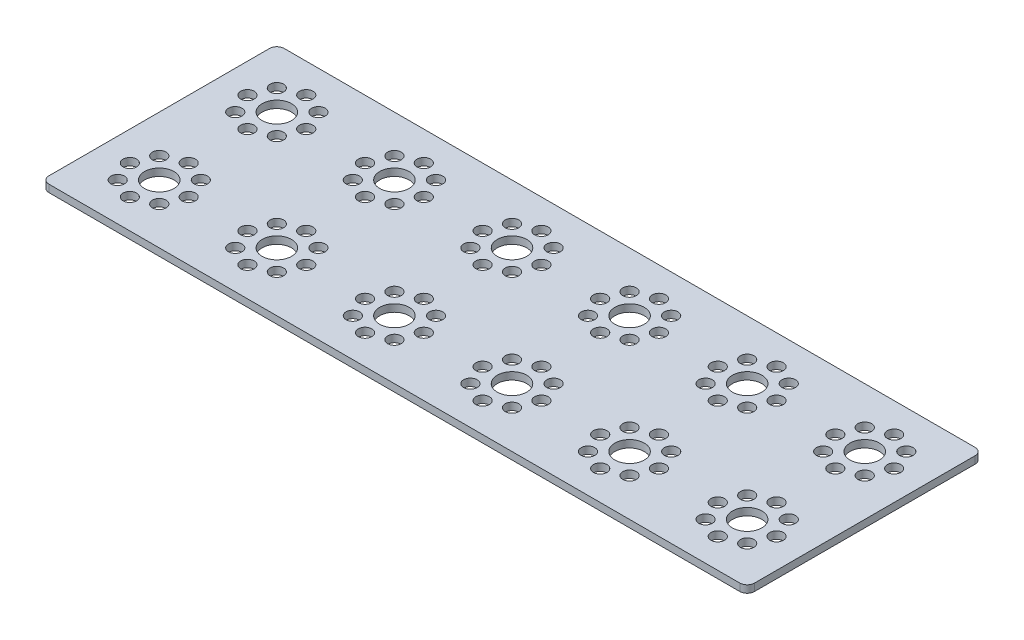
SolidWorks part; units mm, degrees
ref_plane "Front Plane" through (0, 0, 0) normal (0, 0, 1) x (1, 0, 0)
ref_plane "Top Plane" through (0, 0, 0) normal (0, 1, 0) x (1, 0, 0)
ref_plane "Right Plane" through (0, 0, 0) normal (1, 0, 0) x (0, 0, -1)
sketch "Sketch1" plane through (0, 0, 0) normal (0, 1, 0) x (1, 0, 0)
  line L1 (0, 0) -> (192, 0)
  line L2 (0, 0) -> (0, 64)
  line L3 (0, 64) -> (192, 64)
  line L4 (192, 0) -> (192, 64)
  dimension "D1" = 192
  dimension "D2" = 64
extrude "Extrude1" add sketch "Sketch1" along normal blind 2
sketch "Sketch2" plane through (0, 2, 0) normal (0, 1, 0) x (1, 0, 0)
  line L0 (192, 64) -> (0, 64) construction
  line L1 (96, 64) -> (96, 84.1401) construction
  line L2 (96, 64) -> (96, -20.9972) construction
  line L3 (96, -20.9972) -> (96, 0) construction
  line L4 (0, 0) -> (192, 0) construction
  circle B0 centre (80, 48) radius 4
  circle B1 centre (80, 40) radius 1.85
  circle B2 centre (80, 56) radius 1.85
  circle B3 centre (72, 48) radius 1.85
  circle B4 centre (88, 48) radius 1.85
  circle B5 centre (85.66, 53.66) radius 1.85
  circle B6 centre (74.34, 53.66) radius 1.85
  circle B7 centre (85.66, 42.34) radius 1.85
  circle B8 centre (74.34, 42.34) radius 1.85
  circle B9 centre (48, 48) radius 4
  circle B10 centre (48, 40) radius 1.85
  circle B11 centre (48, 56) radius 1.85
  circle B12 centre (40, 48) radius 1.85
  circle B13 centre (56, 48) radius 1.85
  circle B14 centre (53.66, 53.66) radius 1.85
  circle B15 centre (42.34, 53.66) radius 1.85
  circle B16 centre (53.66, 42.34) radius 1.85
  circle B17 centre (42.34, 42.34) radius 1.85
  circle B18 centre (16, 48) radius 4
  circle B19 centre (16, 40) radius 1.85
  circle B20 centre (16, 56) radius 1.85
  circle B21 centre (8, 48) radius 1.85
  circle B22 centre (24, 48) radius 1.85
  circle B23 centre (21.66, 53.66) radius 1.85
  circle B24 centre (10.34, 53.66) radius 1.85
  circle B25 centre (21.66, 42.34) radius 1.85
  circle B26 centre (10.34, 42.34) radius 1.85
  circle B27 centre (112, 48) radius 4
  circle B28 centre (112, 40) radius 1.85
  circle B29 centre (112, 56) radius 1.85
  circle B30 centre (104, 48) radius 1.85
  circle B31 centre (120, 48) radius 1.85
  circle B32 centre (117.66, 53.66) radius 1.85
  circle B33 centre (106.34, 53.66) radius 1.85
  circle B34 centre (117.66, 42.34) radius 1.85
  circle B35 centre (106.34, 42.34) radius 1.85
  circle B36 centre (144, 48) radius 4
  circle B37 centre (144, 40) radius 1.85
  circle B38 centre (144, 56) radius 1.85
  circle B39 centre (136, 48) radius 1.85
  circle B40 centre (152, 48) radius 1.85
  circle B41 centre (149.66, 53.66) radius 1.85
  circle B42 centre (138.34, 53.66) radius 1.85
  circle B43 centre (149.66, 42.34) radius 1.85
  circle B44 centre (138.34, 42.34) radius 1.85
  circle B45 centre (176, 48) radius 4
  circle B46 centre (176, 40) radius 1.85
  circle B47 centre (176, 56) radius 1.85
  circle B48 centre (168, 48) radius 1.85
  circle B49 centre (184, 48) radius 1.85
  circle B50 centre (181.66, 53.66) radius 1.85
  circle B51 centre (170.34, 53.66) radius 1.85
  circle B52 centre (181.66, 42.34) radius 1.85
  circle B53 centre (170.34, 42.34) radius 1.85
  circle B54 centre (176, 16) radius 4
  circle B55 centre (176, 8) radius 1.85
  circle B56 centre (176, 24) radius 1.85
  circle B57 centre (168, 16) radius 1.85
  circle B58 centre (184, 16) radius 1.85
  circle B59 centre (181.66, 21.66) radius 1.85
  circle B60 centre (170.34, 21.66) radius 1.85
  circle B61 centre (181.66, 10.34) radius 1.85
  circle B62 centre (170.34, 10.34) radius 1.85
  circle B63 centre (144, 16) radius 4
  circle B64 centre (144, 8) radius 1.85
  circle B65 centre (144, 24) radius 1.85
  circle B66 centre (136, 16) radius 1.85
  circle B67 centre (152, 16) radius 1.85
  circle B68 centre (149.66, 21.66) radius 1.85
  circle B69 centre (138.34, 21.66) radius 1.85
  circle B70 centre (149.66, 10.34) radius 1.85
  circle B71 centre (138.34, 10.34) radius 1.85
  circle B72 centre (112, 16) radius 4
  circle B73 centre (112, 8) radius 1.85
  circle B74 centre (112, 24) radius 1.85
  circle B75 centre (104, 16) radius 1.85
  circle B76 centre (120, 16) radius 1.85
  circle B77 centre (117.66, 21.66) radius 1.85
  circle B78 centre (106.34, 21.66) radius 1.85
  circle B79 centre (117.66, 10.34) radius 1.85
  circle B80 centre (106.34, 10.34) radius 1.85
  circle B81 centre (80, 16) radius 4
  circle B82 centre (80, 8) radius 1.85
  circle B83 centre (80, 24) radius 1.85
  circle B84 centre (72, 16) radius 1.85
  circle B85 centre (88, 16) radius 1.85
  circle B86 centre (85.66, 21.66) radius 1.85
  circle B87 centre (74.34, 21.66) radius 1.85
  circle B88 centre (85.66, 10.34) radius 1.85
  circle B89 centre (74.34, 10.34) radius 1.85
  circle B90 centre (48, 16) radius 4
  circle B91 centre (48, 8) radius 1.85
  circle B92 centre (48, 24) radius 1.85
  circle B93 centre (40, 16) radius 1.85
  circle B94 centre (56, 16) radius 1.85
  circle B95 centre (53.66, 21.66) radius 1.85
  circle B96 centre (42.34, 21.66) radius 1.85
  circle B97 centre (53.66, 10.34) radius 1.85
  circle B98 centre (42.34, 10.34) radius 1.85
  circle B99 centre (16, 16) radius 4
  circle B100 centre (16, 8) radius 1.85
  circle B101 centre (16, 24) radius 1.85
  circle B102 centre (8, 16) radius 1.85
  circle B103 centre (24, 16) radius 1.85
  circle B104 centre (21.66, 21.66) radius 1.85
  circle B105 centre (10.34, 21.66) radius 1.85
  circle B106 centre (21.66, 10.34) radius 1.85
  circle B107 centre (10.34, 10.34) radius 1.85
  dimension "D1" = 16
  dimension "D2" = 16
  dimension "D3" = 32
  dimension "D4" = 32
  dimension "D5" = 16
  dimension "D6" = 32
  dimension "D7" = 32
  dimension "D8" = 32
sketch_block_instance "Block2-1"
sketch_block "Block2" parameters "D1"=8, "D4"=3.7, "D5"=3.7, "D7"=3.7, "D9"=3.7, "D10"=3.7, "D14"=3.7, "D16"=3.7, "D17"=3.7, "D2"=8, "D3"=8, "D6"=8, "D8"=8, "D11"=5.66, "D12"=5.66, "D13"=5.66, "D15"=5.66, "D18"=5.66, "D19"=5.66
sketch_block_instance "Block2-2"
sketch_block_instance "Block2-3"
sketch_block_instance "Block2-4"
sketch_block_instance "Block2-5"
sketch_block_instance "Block2-6"
sketch_block_instance "Block2-7"
sketch_block_instance "Block2-8"
sketch_block_instance "Block2-9"
sketch_block_instance "Block2-10"
sketch_block_instance "Block2-11"
sketch_block_instance "Block2-12"
extrude "Cut-Extrude1" cut sketch "Sketch2" against normal through all
fillet "Fillet1" radius 2 1 edges at (0, 1, 0)
fillet "Fillet2" radius 2 1 edges at (0, 1, -64)
fillet "Fillet3" radius 2 1 edges at (192, 1, 0)
fillet "Fillet4" radius 2 1 edges at (192, 1, -64)
